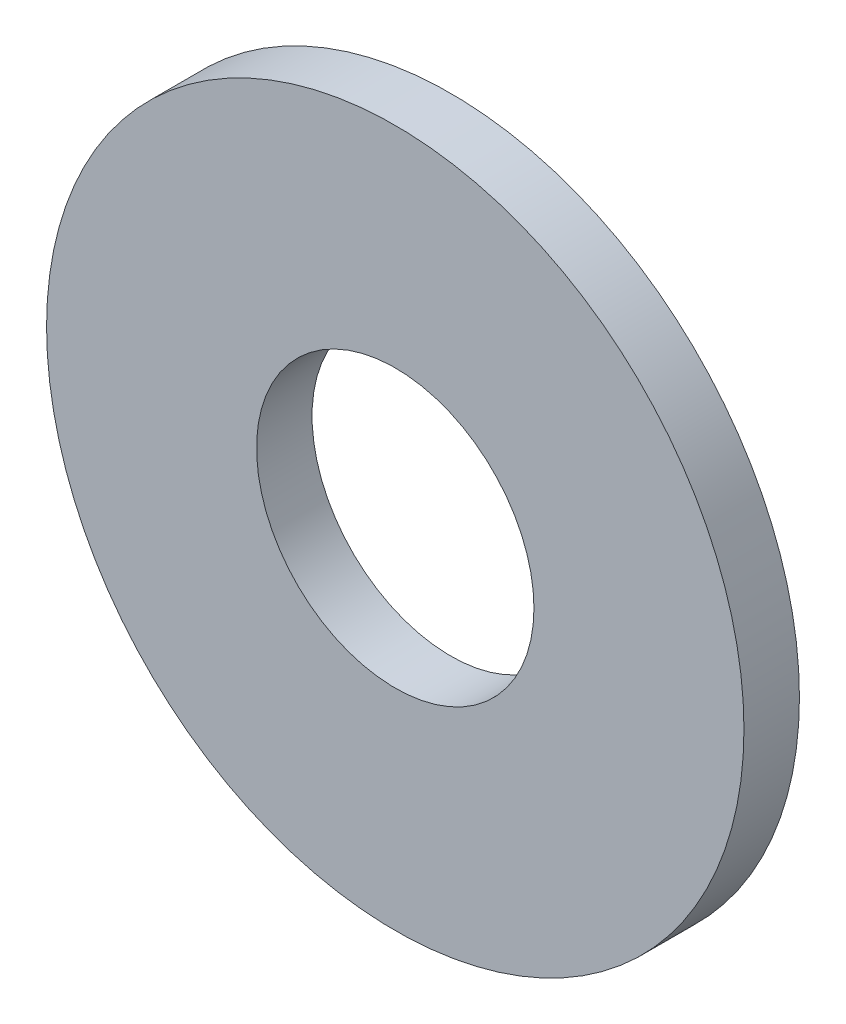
SolidWorks part; units mm, degrees
ref_plane "Face" through (0, 0, 0) normal (0, 0, 1) x (1, 0, 0)
ref_plane "Dessus" through (0, 0, 0) normal (0, 1, 0) x (1, 0, 0)
ref_plane "Droite" through (0, 0, 0) normal (1, 0, 0) x (0, 0, -1)
sketch "Esquisse1" plane through (0, 0, 0) normal (0, 0, 1) x (1, 0, 0)
  circle A0 centre (0, 0) radius 4.4
  circle A1 centre (0, 0) radius 1.75
  dimension "D1" = 3.5
  dimension "D2" = 8.8
extrude "Extrusion1" add sketch "Esquisse1" along normal blind 0.7
